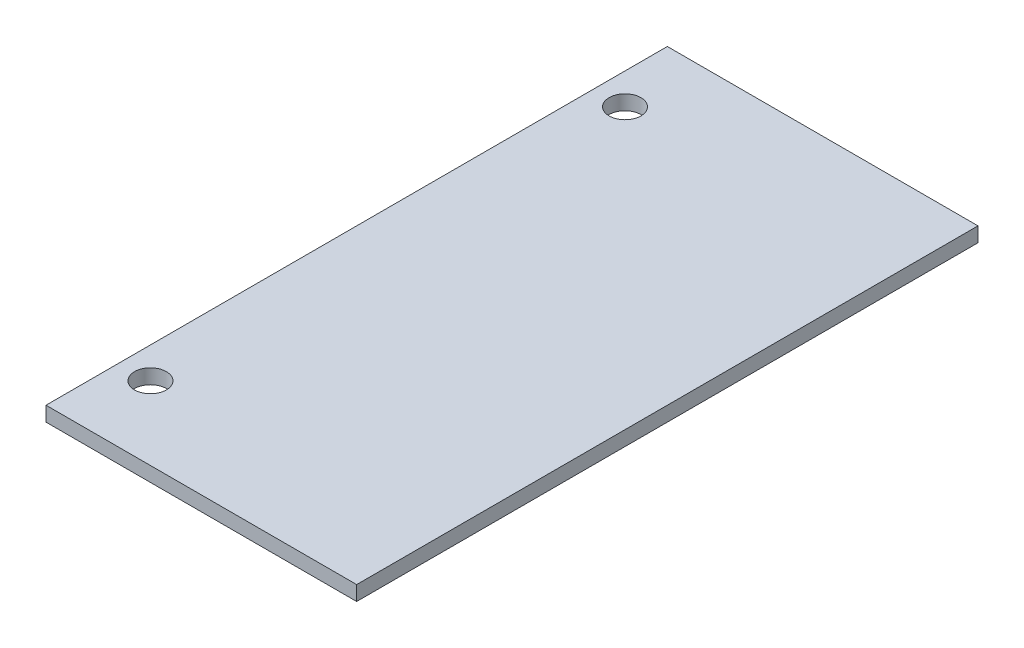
SolidWorks part; units mm, degrees
ref_plane "Front" through (0, 0, 0) normal (0, 0, 1) x (1, 0, 0)
ref_plane "Top" through (0, 0, 0) normal (0, 1, 0) x (1, 0, 0)
ref_plane "Right" through (0, 0, 0) normal (1, 0, 0) x (0, 0, -1)
sketch "Sketch1" plane through (0, 0, 0) normal (0, 1, 0) x (1, 0, 0)
  line L0 (-63.5, -127) -> (63.5, 127) construction
  line L1 (-63.5, 127) -> (63.5, 127)
  line L2 (-63.5, 127) -> (-63.5, -127)
  line L3 (-63.5, -127) -> (63.5, -127)
  line L4 (63.5, 127) -> (63.5, -127)
  dimension "D1" = 254
  dimension "D2" = 127
extrude "Extrude1" add sketch "Sketch1" along normal blind 6
sketch "Sketch2" plane through (0, 6, 0) normal (0, 1, 0) x (1, 0, 0)
  line L0 (-63.5, -127) -> (63.5, -127) construction
  line L1 (63.5, 127) -> (-63.5, 127) construction
  line L2 (-63.5, 127) -> (-63.5, -127) construction
  circle A0 centre (-50.8, -97) radius 6.5
  circle A1 centre (-50.8, 97) radius 6.5
  dimension "D1" = 13
  dimension "D3" = 30
  dimension "D4" = 12.7
  dimension "D2" = 30
extrude "Cut-Extrude1" cut sketch "Sketch2" against normal through all
